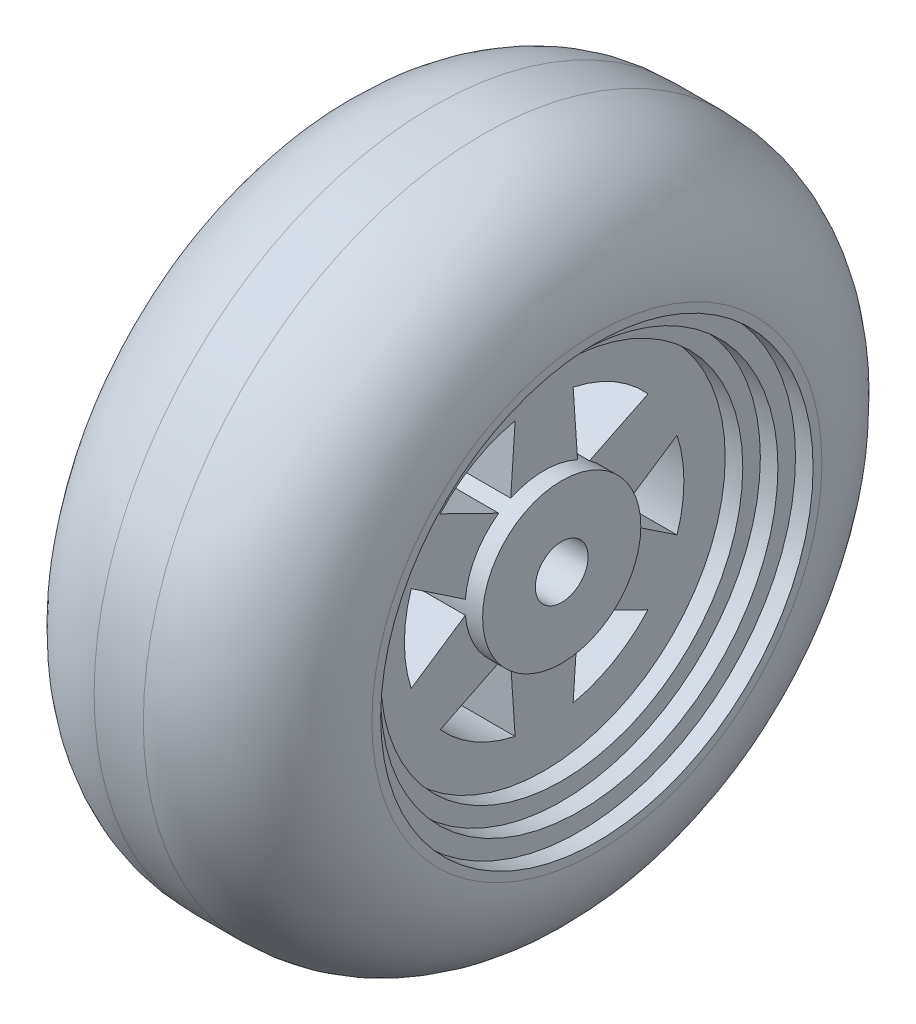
SolidWorks part; units mm, degrees
ref_plane "Plan de face" through (0, 0, 0) normal (0, 0, 1) x (1, 0, 0)
ref_plane "Plan de dessus" through (0, 0, 0) normal (0, 1, 0) x (1, 0, 0)
ref_plane "Plan de droite" through (0, 0, 0) normal (1, 0, 0) x (0, 0, -1)
sketch "Esquisse1" plane through (0, 0, 0) normal (1, 0, 0) x (0, 0, -1)
  line L0 (85.7425, 0) -> (-40.1398, 0) construction
  line L1 (0, -38.596) -> (0, 88.4739) construction
  line L2 (1.9, 4.0792) -> (1.65, 7.7769)
  line L3 (1.9, 5.0499) -> (1.9, 2.7605) construction
  line L4 (1.65, 9.3797) -> (1.65, 7.5881) construction
  line L5 (-1.9, 4.0792) -> (-1.65, 7.7769)
  line L6 (4.4827, 0.3942) -> (7.56, 2.4595)
  line L7 (2.5827, 3.6851) -> (5.91, 5.3174)
  line L8 (2.5827, -3.6851) -> (5.91, -5.3174)
  line L9 (4.4827, -0.3942) -> (7.56, -2.4595)
  line L10 (-1.9, -4.0792) -> (-1.65, -7.7769)
  line L11 (1.9, -4.0792) -> (1.65, -7.7769)
  line L12 (-4.4827, -0.3942) -> (-7.56, -2.4595)
  line L13 (-2.5827, -3.6851) -> (-5.91, -5.3174)
  line L14 (-2.5827, 3.6851) -> (-5.91, 5.3174)
  line L15 (-4.4827, 0.3942) -> (-7.56, 2.4595)
  circle A0 centre (0, 0) radius 19.3
  arc A2 (1.9, -4.0792) -> (2.5827, -3.6851) centre (0, 0) ccw
  arc A3 (1.65, -7.7769) -> (5.91, -5.3174) centre (0, 0) ccw
  arc A4 (4.4827, -0.3942) -> (4.4827, 0.3942) centre (0, 0) ccw
  arc A5 (7.56, -2.4595) -> (7.56, 2.4595) centre (0, 0) ccw
  arc A6 (2.5827, 3.6851) -> (1.9, 4.0792) centre (0, 0) ccw
  arc A7 (5.91, 5.3174) -> (1.65, 7.7769) centre (0, 0) ccw
  arc A8 (-1.9, 4.0792) -> (-2.5827, 3.6851) centre (0, 0) ccw
  arc A9 (-1.65, 7.7769) -> (-5.91, 5.3174) centre (0, 0) ccw
  arc A10 (-4.4827, 0.3942) -> (-4.4827, -0.3942) centre (0, 0) ccw
  arc A11 (-7.56, 2.4595) -> (-7.56, -2.4595) centre (0, 0) ccw
  arc A12 (-2.5827, -3.6851) -> (-1.9, -4.0792) centre (0, 0) ccw
  arc A13 (-5.91, -5.3174) -> (-1.65, -7.7769) centre (0, 0) ccw
  dimension "D1" = 1.65
  dimension "D2" = 1.9
extrude "Extrusion1" add sketch "Esquisse1" along normal blind 15.8
sketch "Esquisse2" plane through (15.8, 0, 0) normal (1, 0, 0) x (0, 0, -1)
  circle A0 centre (0, 0) radius 12.3
extrude "Enlèv. mat.-Extru.1" cut sketch "Esquisse2" against normal blind 1
sketch "Esquisse3" plane through (14.8, 0, 0) normal (1, 0, 0) x (0, 0, -1)
  circle A0 centre (0, 0) radius 11.3
extrude "Enlèv. mat.-Extru.2" cut sketch "Esquisse3" against normal blind 1
sketch "Esquisse4" plane through (13.8, 0, 0) normal (1, 0, 0) x (0, 0, -1)
  circle A0 centre (0, 0) radius 10.3
extrude "Enlèv. mat.-Extru.3" cut sketch "Esquisse4" against normal blind 1
sketch "Esquisse6" plane through (0, 0, 0) normal (-1, 0, 0) x (0, 0, 1)
  circle A0 centre (0, 0) radius 12.3
extrude "Enlèv. mat.-Extru.4" cut sketch "Esquisse6" against normal blind 1
sketch "Esquisse7" plane through (1, 0, 0) normal (-1, 0, 0) x (0, 0, 1)
  circle A0 centre (0, 0) radius 4.5
extrude "Extrusion3" add sketch "Esquisse7" along normal blind 5
sketch "Esquisse8" plane through (12.8, 0, 0) normal (1, 0, 0) x (0, 0, -1)
  circle A0 centre (0, 0) radius 4.5
extrude "Extrusion4" add sketch "Esquisse8" along normal blind 1
sketch "Esquisse9" plane through (13.8, 0, 0) normal (1, 0, 0) x (0, 0, -1)
  circle A0 centre (0, 0) radius 1.5
extrude "Enlèv. mat.-Extru.5" cut sketch "Esquisse9" against normal through all
fillet "Congé1" radius 6.5 2 edges at (15.8, 0, -19.3) (0, 0, -19.3)
